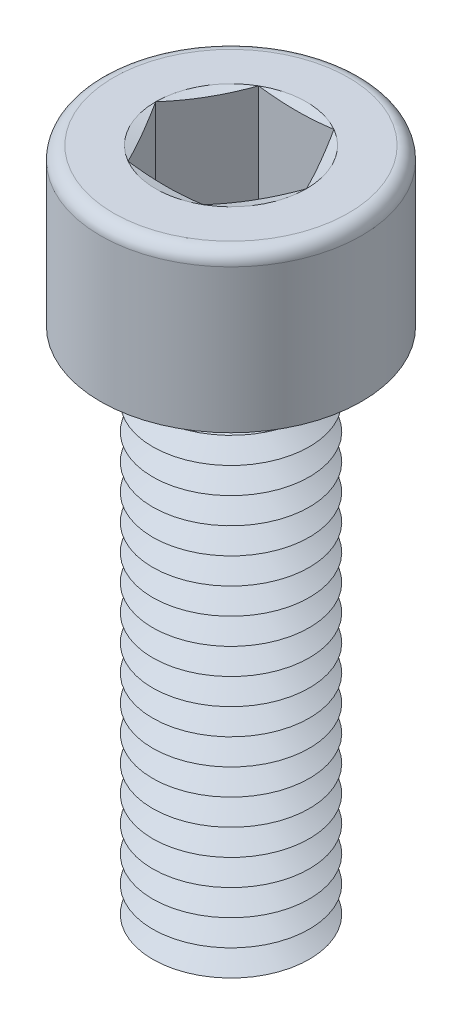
SolidWorks part; units mm, degrees
ref_plane "Front Plane" through (0, 0, 0) normal (0, 0, 1) x (1, 0, 0)
ref_plane "Top Plane" through (0, 0, 0) normal (0, 1, 0) x (1, 0, 0)
ref_plane "Right Plane" through (0, 0, 0) normal (1, 0, 0) x (0, 0, -1)
sketch "Sketch1" plane through (0, 0, 0) normal (0, 1, 0) x (1, 0, 0)
  circle A0 centre (0, 0) radius 3
  dimension "D1" = 6
extrude "Extrude1" add sketch "Sketch1" along normal blind 20
sketch "Sketch2" plane through (0, 20, 0) normal (0, 1, 0) x (1, 0, 0)
  circle A0 centre (0, 0) radius 5
  dimension "D1" = 10
extrude "Extrude2" add sketch "Sketch2" along normal blind 6
sketch "Sketch3" plane through (0, 26, 0) normal (0, 1, 0) x (1, 0, 0)
  line L1 (1.4434, 2.5) -> (-1.4434, 2.5)
  line L2 (-1.4434, 2.5) -> (-2.8868, 0)
  line L3 (-2.8868, 0) -> (-1.4434, -2.5)
  line L4 (-1.4434, -2.5) -> (1.4434, -2.5)
  line L5 (1.4434, -2.5) -> (2.8868, 0)
  line L6 (2.8868, 0) -> (1.4434, 2.5)
  circle A0 centre (0, 0) radius 2.5 construction
  dimension "D1" = 5
extrude "Extrude3" cut sketch "Sketch3" against normal blind 5
fillet "Fillet1" radius 0.5 1 edges at (0, 26, 5)
sketch "Sketch4" plane through (0, 0, 0) normal (1, 0, 0) x (0, 0, -1)
  line L0 (-2.5, 21) -> (0, 21)
  line L1 (0, 21) -> (0, 19.5566)
  line L2 (0, 19.5566) -> (-2.5, 21)
  dimension "D1" = 30
revolve "Cut-Revolve1" cut sketch "Sketch4" angle 360 about L1
sketch "Sketch5" plane through (0, 0, 0) normal (0, 0, 1) x (1, 0, 0)
  line L0 (-3, 0.5) -> (-3, -0.5)
  line L1 (-3, 20) -> (-3, 0) construction
  line L2 (-3, -0.5) -> (-2.134, 0)
  line L3 (-3, 0) -> (3, 0) construction
  line L4 (-2.134, 0) -> (-3, 0.5)
  dimension "D1" = 1
revolve "Cut-Revolve2" cut sketch "Sketch5" angle 360 about axis through (0, 20, 0) along (0, -1, 0)
pattern_linear "LPattern1" count 20 spacing 1 along (0, 1, 0) of "Cut-Revolve2"
sketch "Sketch6" plane through (0, 26, 0) normal (0, 1, 0) x (1, 0, 0)
  circle A0 centre (0, 0) radius 2.8868
extrude "Extrude4" cut sketch "Sketch6" against normal through all draft 75
